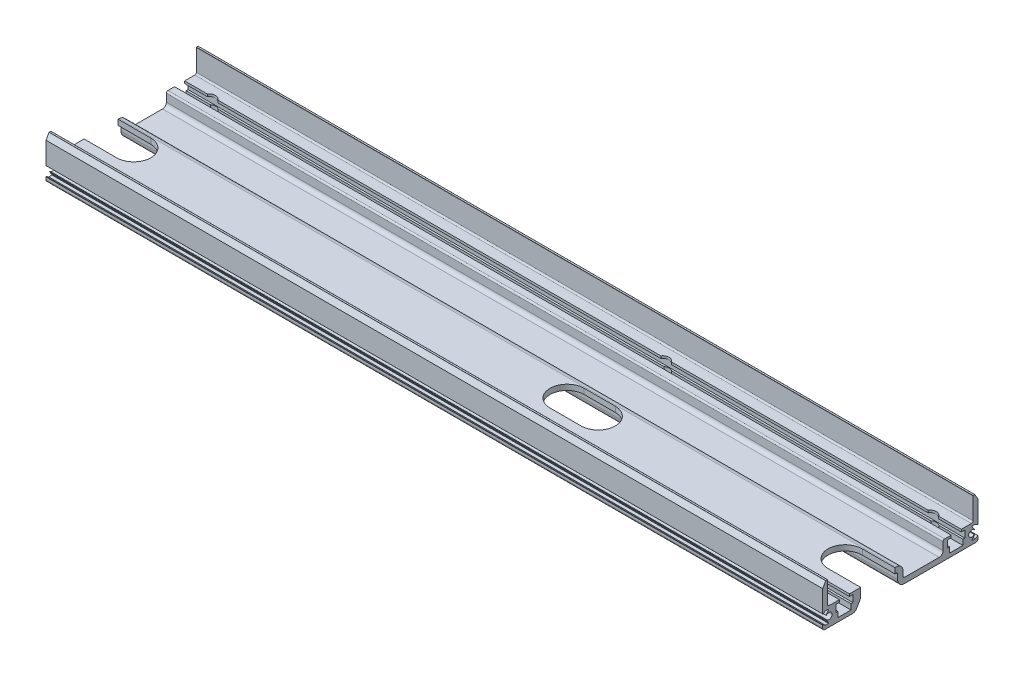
SolidWorks part; units mm, degrees
ref_plane "Plan1" through (0, 0, 0) normal (0, 0, 1) x (1, 0, 0)
ref_plane "Plan2" through (0, 0, 0) normal (0, 1, 0) x (1, 0, 0)
ref_plane "Plan3" through (0, 0, 0) normal (1, 0, 0) x (0, 0, -1)
sketch "Esquisse2" plane through (0, 0, 0) normal (1, 0, 0) x (0, 0, -1)
  line L0 (-48.5, 0) -> (-30.75, 0)
  line L1 (0, 51.5) -> (0, -10) construction
  line L2 (50, 27) -> (50, 1.5)
  line L11 (-50, 1.5) -> (-50, 27)
  line L15 (-50, 27) -> (-46.8, 27)
  line L16 (-2.75, 12) -> (-32.75, 12)
  line L17 (-46.8, 27) -> (-46.8, 13)
  line L19 (-36, 23.5) -> (-36, -2.5) construction
  line L20 (-32.75, 12) -> (-32.75, 10.5)
  line L21 (-32.75, 10.5) -> (-30.5, 10.5)
  line L22 (-30.5, 10.5) -> (-30.5, 6)
  line L23 (-30.5, 6) -> (-31.75, 6)
  line L24 (-31.75, 6) -> (-31.75, 2.5)
  line L25 (-31.75, 2.5) -> (-40.25, 2.5)
  line L26 (-40.25, 6) -> (-40.25, 2.5)
  line L27 (-41.5, 6) -> (-40.25, 6)
  line L28 (-41.5, 10.5) -> (-41.5, 6)
  line L29 (-39.25, 10.5) -> (-41.5, 10.5)
  line L30 (-39.25, 12) -> (-39.25, 10.5)
  line L31 (-39.25, 12) -> (-45.8, 12)
  line L32 (39.25, 12) -> (45.8, 12)
  line L33 (39.25, 12) -> (39.25, 10.5)
  line L34 (39.25, 10.5) -> (41.5, 10.5)
  line L35 (41.5, 10.5) -> (41.5, 6)
  line L36 (41.5, 6) -> (40.25, 6)
  line L37 (40.25, 6) -> (40.25, 2.5)
  line L38 (31.75, 2.5) -> (40.25, 2.5)
  line L39 (31.75, 6) -> (31.75, 2.5)
  line L40 (30.5, 6) -> (31.75, 6)
  line L41 (30.5, 10.5) -> (30.5, 6)
  line L42 (32.75, 10.5) -> (30.5, 10.5)
  line L43 (32.75, 12) -> (32.75, 10.5)
  line L45 (46.8, 27) -> (46.8, 13)
  line L46 (50, 27) -> (46.8, 27)
  line L57 (-2.75, 8.5) -> (-22.3784, 8.5)
  line L58 (-26.5, 15) -> (-26.5, -10) construction
  line L59 (-24.9765, 7) -> (-28.1519, 1.5)
  line L60 (-1.75, 7.5) -> (-1.75, 4.5)
  line L61 (2.75, 0) -> (48.5, 0)
  line L62 (2.75, 3.5) -> (25, 3.5)
  line L63 (1.75, 7.5) -> (1.75, 4.5)
  line L64 (36, 2.5) -> (36, 18) construction
  line L65 (27.5, 11) -> (27.5, 6)
  line L66 (32.75, 12) -> (28.5, 12)
  arc A1 (-48.5, 0) -> (-50, 1.5) centre (-48.5, 1.5) cw
  arc A22 (48.5, 0) -> (50, 1.5) centre (48.5, 1.5) ccw
  arc A24 (-28.1519, 1.5) -> (-30.75, 0) centre (-30.75, 3) cw
  arc A25 (-22.3784, 8.5) -> (-24.9765, 7) centre (-22.3784, 5.5) ccw
  arc A26 (-1.75, 7.5) -> (-2.75, 8.5) centre (-2.75, 7.5) ccw
  arc A27 (2.75, 0) -> (-1.75, 4.5) centre (2.75, 4.5) cw
  arc A28 (1.75, 7.5) -> (-2.75, 12) centre (-2.75, 7.5) ccw
  arc A29 (2.75, 3.5) -> (1.75, 4.5) centre (2.75, 4.5) cw
  arc A30 (27.5, 6) -> (25, 3.5) centre (25, 6) cw
  arc A31 (28.5, 12) -> (27.5, 11) centre (28.5, 11) ccw
  arc A32 (46.8, 13) -> (45.8, 12) centre (45.8, 13) cw
  arc A33 (-46.8, 13) -> (-45.8, 12) centre (-45.8, 13) ccw
  point P62 (-36, 2.5)
  point P122 (36, 2.5)
  point P151 (46.8, 12)
  point P154 (-46.8, 12)
  dimension "D3" = 1
  dimension "D8" = 1.5
  dimension "D9" = 27
  dimension "D21" = 3
  dimension "D28" = 4.5
  dimension "D29" = 1
  dimension "D31" = 2.5
  dimension "D1" = 1.25
  dimension "D2" = 51.75
  dimension "D4" = 3.2
  dimension "D11" = 12
  dimension "D13" = 36
  dimension "D14" = 3.25
  dimension "D15" = 5.5
  dimension "D16" = 1.5
  dimension "D17" = 4.5
  dimension "D18" = 3.5
  dimension "D19" = 23.5
  dimension "D20" = 30
  dimension "D22" = 3.5
  dimension "D26" = 3.5
  dimension "D27" = 3.5
  dimension "D30" = 8.5
  dimension "D33" = 50
extrude "profilé" add sketch "Esquisse2" along normal mid plane 500
chamfer "Chanfrein1" distance 2 angle 60
chamfer "Chanfrein3" distance 2 angle 60
fillet "Congé5" radius 0.1
sketch "Esquisse4" plane through (-250, 0, 0) normal (-1, 0, 0) x (0, 0, 1)
  line L0 (-47.9335, 5) -> (-47.5612, 5)
  line L1 (-50, 6.25) -> (-43.2574, 6.25) construction
  line L2 (-50, 1.5) -> (-50, 23.5359) construction
  line L3 (-2.75, 0) -> (-48.5, 0) construction
  line L4 (-48.2679, 10.25) -> (-46.2, 10.25)
  line L5 (-50, 9.25) -> (-48.2679, 10.25)
  line L6 (-46.1181, 10.0926) -> (-47.9335, 7.5)
  line L7 (-47.9335, 7.5) -> (-47.5612, 7.5)
  line L8 (-50, 9.25) -> (-50, 3.25)
  line L9 (-46.1181, 2.4074) -> (-47.9335, 5)
  line L10 (-50, 3.25) -> (-48.2679, 2.25)
  line L11 (-48.2679, 2.25) -> (-46.2, 2.25)
  arc A0 (-47.5612, 5) -> (-47.5612, 7.5) centre (-46, 6.25) ccw
  arc A1 (-46.1181, 10.0926) -> (-46.2, 10.25) centre (-46.2, 10.15) ccw
  arc A2 (-46.1181, 2.4074) -> (-46.2, 2.25) centre (-46.2, 2.35) cw
  dimension "D2" = 4
  dimension "D3" = 2
  dimension "D9" = 0.2
  dimension "D1" = 6.25
  dimension "D4" = 4
  dimension "D5" = 1.25
  dimension "D6" = 55
  dimension "D7" = 60
  dimension "D8" = 3
  dimension "D10" = 3.8
extrude "Enlèv. mat.-Extru.1" cut sketch "Esquisse4" against normal through all
fillet "Congé2" radius 0.1
mirror "Symétrie1" about plane through (0, 0, 0) normal (0, 0, 1)
fillet "Congé3" radius 0.1
sketch "Esquisse6" plane through (0, 0, 0) normal (0, -1, 0) x (1, 0, 0)
  line L0 (250, 2.75) -> (250, 32.75) construction
  line L1 (250, 50) -> (-250, 50) construction
  circle A0 centre (232, 37) radius 4.1
  dimension "D3" = 8.2
  dimension "D1" = 18
  dimension "D2" = 13
extrude "Enlèv. mat.-Extru.3" cut sketch "Esquisse6" against normal through all
sketch "Esquisse3" plane through (0, 12, 0) normal (0, 1, 0) x (-1, 0, 0)
  line L0 (-229, 25.5) -> (-250, 25.5)
  line L5 (0, 0) -> (0, 56.5) construction
  line L8 (229, 3.5) -> (250, 3.5)
  line L9 (250, 3.5) -> (250, 25.5)
  line L11 (229, 25.5) -> (250, 25.5)
  line L18 (-250, 3.5) -> (-250, 25.5)
  line L20 (-229, 3.5) -> (-250, 3.5)
  line L23 (-250, 31.75) -> (-250, 40.25) construction
  line L25 (-50, 3.5) -> (-70, 3.5)
  line L26 (-50, 25.5) -> (-70, 25.5)
  arc A0 (229, 25.5) -> (229, 3.5) centre (229, 14.5) ccw
  arc A2 (-234.4995, 40.25) -> (-229.5005, 40.25) centre (-232, 37) ccw construction
  arc A3 (-228.5725, 39.25) -> (-235.4275, 39.25) centre (-232, 37) ccw construction
  arc A5 (-229, 25.5) -> (-229, 3.5) centre (-229, 14.5) cw
  arc A6 (-70, 25.5) -> (-70, 3.5) centre (-70, 14.5) ccw
  arc A9 (-50, 25.5) -> (-50, 3.5) centre (-50, 14.5) cw
  dimension "D1" = 22.5
  dimension "D2" = 11
  dimension "D3" = 21
  dimension "D7" = 20
  dimension "D4" = 162
extrude "percages" cut sketch "Esquisse3" against normal through all
ref_plane "Plan rainure 1" through (0, 0, 36) normal (0, 0, 1) x (1, 0, 0)
ref_plane "Plan rainure 2" through (0, 0, -36) normal (0, 0, 1) x (1, 0, 0)
pattern_linear "Répétition linéaire2" count 2 spacing 74 count 2 spacing 172
pattern_linear "Répétition linéaire3" count 2 spacing 74 count 2 spacing 464
